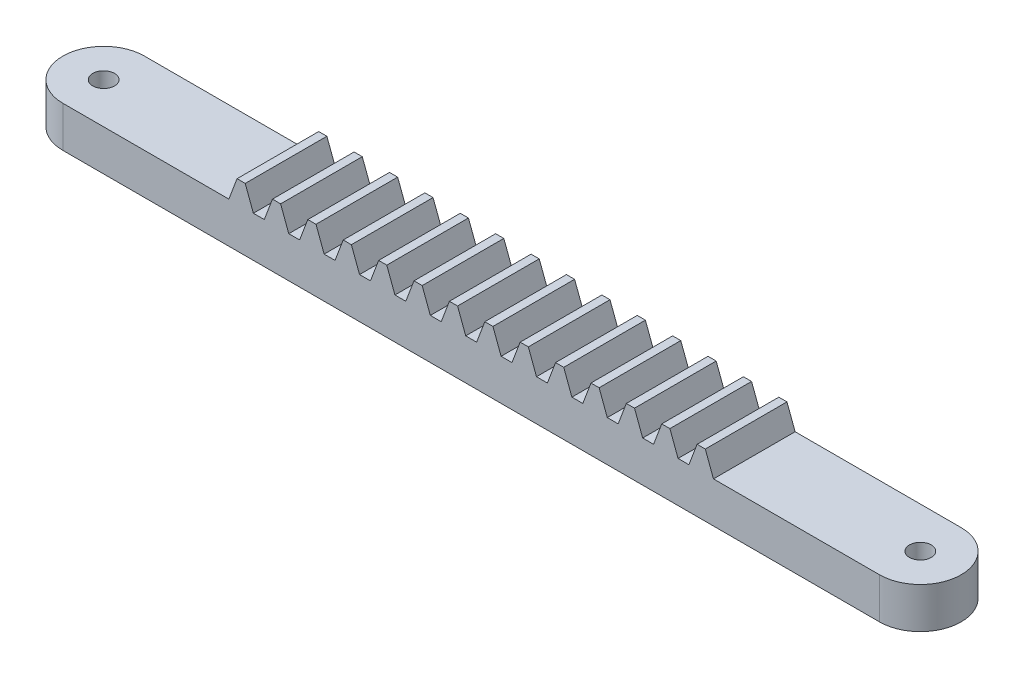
SolidWorks part; units mm, degrees
ref_plane "Front Plane" through (0, 0, 0) normal (0, 0, 1) x (1, 0, 0)
ref_plane "Top Plane" through (0, 0, 0) normal (0, 1, 0) x (1, 0, 0)
ref_plane "Right Plane" through (0, 0, 0) normal (1, 0, 0) x (0, 0, -1)
sketch "Sketch1" plane through (0, 0, 0) normal (0, 0, 1) x (1, 0, 0)
  line L1 (0, 0) -> (76.2, 0)
  line L2 (0, 0) -> (0, 3.81)
  line L3 (0, 3.81) -> (76.2, 3.81)
  line L4 (76.2, 0) -> (76.2, 3.81)
  dimension "D1" = 3.81
  dimension "D2" = 76.2
extrude "Boss-Extrude1" add sketch "Sketch1" along normal blind 7.62
sketch "Sketch2" plane through (0, 0, 7.62) normal (0, 0, 1) x (1, 0, 0)
  line L0 (38.1, -1.9651) -> (38.1, 8.2777) construction
  line L1 (37.592, 3.81) -> (36.83, 5.842)
  line L2 (76.2, 3.81) -> (0, 3.81) construction
  line L3 (36.83, 5.842) -> (36.068, 5.842)
  line L4 (36.068, 5.842) -> (35.306, 3.81)
  line L5 (35.306, 3.81) -> (37.592, 3.81)
  line L6 (32.004, 3.81) -> (34.29, 3.81)
  line L7 (34.29, 3.81) -> (33.528, 5.842)
  line L8 (33.528, 5.842) -> (32.766, 5.842)
  line L9 (32.766, 5.842) -> (32.004, 3.81)
  line L10 (28.702, 3.81) -> (30.988, 3.81)
  line L11 (30.988, 3.81) -> (30.226, 5.842)
  line L12 (30.226, 5.842) -> (29.464, 5.842)
  line L13 (29.464, 5.842) -> (28.702, 3.81)
  line L14 (25.4, 3.81) -> (27.686, 3.81)
  line L15 (27.686, 3.81) -> (26.924, 5.842)
  line L16 (26.924, 5.842) -> (26.162, 5.842)
  line L17 (26.162, 5.842) -> (25.4, 3.81)
  line L18 (22.098, 3.81) -> (24.384, 3.81)
  line L19 (24.384, 3.81) -> (23.622, 5.842)
  line L20 (23.622, 5.842) -> (22.86, 5.842)
  line L21 (22.86, 5.842) -> (22.098, 3.81)
  line L22 (18.796, 3.81) -> (21.082, 3.81)
  line L23 (21.082, 3.81) -> (20.32, 5.842)
  line L24 (20.32, 5.842) -> (19.558, 5.842)
  line L25 (19.558, 5.842) -> (18.796, 3.81)
  line L26 (15.494, 3.81) -> (17.78, 3.81)
  line L27 (17.78, 3.81) -> (17.018, 5.842)
  line L28 (17.018, 5.842) -> (16.256, 5.842)
  line L29 (16.256, 5.842) -> (15.494, 3.81)
  line L30 (59.944, 5.842) -> (60.706, 3.81)
  line L31 (59.182, 5.842) -> (59.944, 5.842)
  line L32 (58.42, 3.81) -> (59.182, 5.842)
  line L33 (60.706, 3.81) -> (58.42, 3.81)
  line L34 (56.642, 5.842) -> (57.404, 3.81)
  line L35 (55.88, 5.842) -> (56.642, 5.842)
  line L36 (55.118, 3.81) -> (55.88, 5.842)
  line L37 (57.404, 3.81) -> (55.118, 3.81)
  line L38 (53.34, 5.842) -> (54.102, 3.81)
  line L39 (52.578, 5.842) -> (53.34, 5.842)
  line L40 (51.816, 3.81) -> (52.578, 5.842)
  line L41 (54.102, 3.81) -> (51.816, 3.81)
  line L42 (50.038, 5.842) -> (50.8, 3.81)
  line L43 (49.276, 5.842) -> (50.038, 5.842)
  line L44 (48.514, 3.81) -> (49.276, 5.842)
  line L45 (50.8, 3.81) -> (48.514, 3.81)
  line L46 (46.736, 5.842) -> (47.498, 3.81)
  line L47 (45.974, 5.842) -> (46.736, 5.842)
  line L48 (45.212, 3.81) -> (45.974, 5.842)
  line L49 (47.498, 3.81) -> (45.212, 3.81)
  line L50 (43.434, 5.842) -> (44.196, 3.81)
  line L51 (42.672, 5.842) -> (43.434, 5.842)
  line L52 (41.91, 3.81) -> (42.672, 5.842)
  line L53 (44.196, 3.81) -> (41.91, 3.81)
  line L54 (40.894, 3.81) -> (38.608, 3.81)
  line L55 (40.132, 5.842) -> (40.894, 3.81)
  line L56 (39.37, 5.842) -> (40.132, 5.842)
  line L57 (38.608, 3.81) -> (39.37, 5.842)
  dimension "D1" = 2.032
  dimension "D2" = 0.508
  dimension "D3" = 2.286
  dimension "D4" = 0.762
  dimension "D5" = 7
extrude "Boss-Extrude2" add sketch "Sketch2" against normal blind 7.62
sketch "Sketch3" plane through (0, 3.81, 0) normal (0, 1, 0) x (1, 0, 0)
  line L0 (0, -7.62) -> (0, 0) construction
  line L1 (76.2, -7.62) -> (76.2, 0) construction
  circle A0 centre (0, -3.81) radius 3.81
  circle A1 centre (76.2, -3.81) radius 3.81
extrude "Boss-Extrude3" add sketch "Sketch3" against normal blind 3.81
sketch "Sketch4" plane through (0, 3.81, 0) normal (0, 1, 0) x (1, 0, 0)
  circle A0 centre (0, -3.81) radius 1.016
  circle A1 centre (76.2, -3.81) radius 1.016
  dimension "D1" = 2.032
  dimension "D2" = 2.032
extrude "Cut-Extrude1" cut sketch "Sketch4" against normal through all
